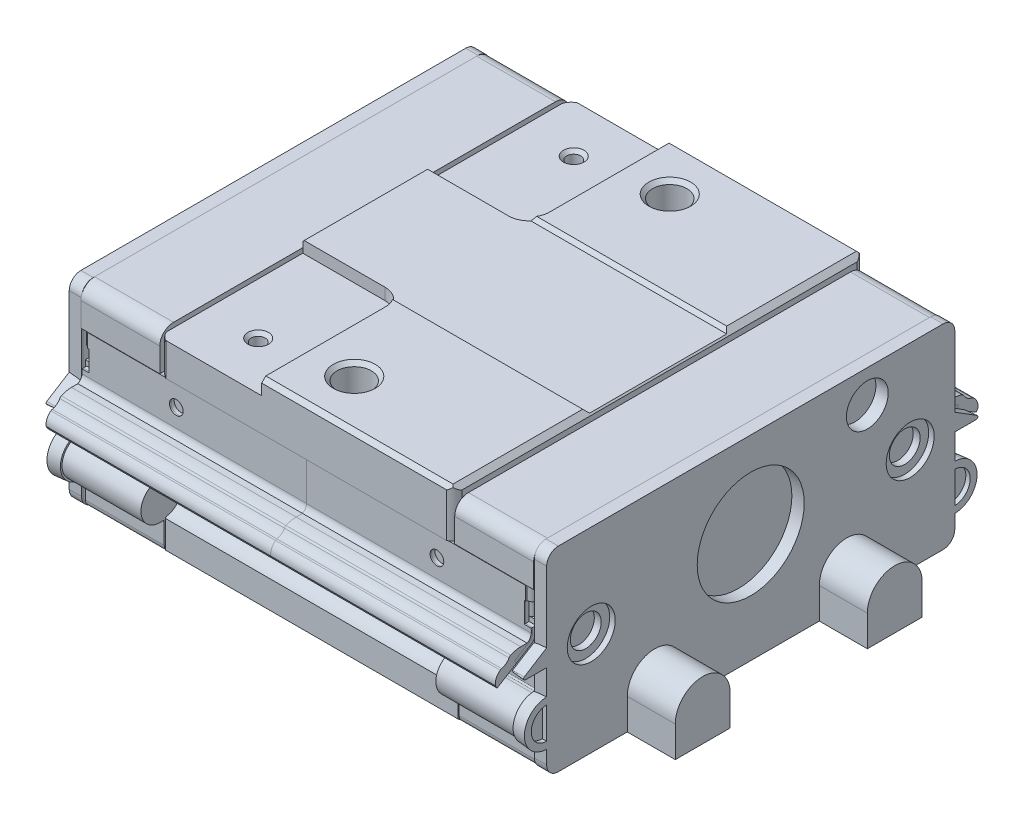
SolidWorks part; units mm, degrees
ref_plane "前视基准面" through (0, 0, 0) normal (0, 0, 1) x (1, 0, 0)
ref_plane "上视基准面" through (0, 0, 0) normal (0, 1, 0) x (1, 0, 0)
ref_plane "右视基准面" through (0, 0, 0) normal (1, 0, 0) x (0, 0, -1)
imported_body "KKR86-SST-P-G-1610_W-1-solid1"
imported_body "KKR86-FSFT-P_W-1-solid1"
imported_body "KKR86-FSD-P-1/KKR86-FSDB-P-1-solid1"
imported_body "KKR86-FSD-P-1/KKR86-FSDJ-P-1-solid1"
imported_body "KKR86-SSC-P-1-solid1"
imported_body "KKR86-SSC-P-1-solid2"
imported_body "KKR86-SSC-P-1-solid3"
imported_body "KKR86-SSC-P-1-solid4"
imported_body "KKR86-SSC-P-2-solid1"
imported_body "KKR86-SSC-P-2-solid2"
imported_body "KKR86-SSC-P-2-solid3"
imported_body "KKR86-SSC-P-2-solid4"
imported_body "KKR86-FSFT-P_W-2-solid1"
imported_body "KKR86-FSD-P-2/KKR86-FSDB-P-1-solid1"
imported_body "KKR86-FSD-P-2/KKR86-FSDJ-P-1-solid1"
sketch "草图1" plane through (0, 0, 30.15) normal (0, 0, -1) x (-1, 0, 0)
  line L0 (32.5327, 5.6248) -> (21.0294, 5.6248) construction
  line L1 (23.885, 5.6248) -> (30.0915, 5.6248)
  line L2 (23.885, 5.6248) -> (23.885, 8.3345)
  line L3 (23.885, 8.3345) -> (30.0915, 8.3345)
  line L4 (30.0915, 5.6248) -> (30.0915, 8.3345)
extrude "切除-拉伸1" cut sketch "草图1" along normal blind 10
sketch "草图2" plane through (0, 0, 89.85) normal (0, 0, 1) x (1, 0, 0)
  line L0 (33.4738, 9.1248) -> (21.9706, 9.1248) construction
  line L1 (24.3187, 9.1248) -> (30.2858, 9.1248)
  line L2 (24.3187, 9.1248) -> (24.3187, 6.1979)
  line L3 (24.3187, 6.1979) -> (30.2858, 6.1979)
  line L4 (30.2858, 9.1248) -> (30.2858, 6.1979)
extrude "切除-拉伸2" cut sketch "草图2" along normal blind 10
